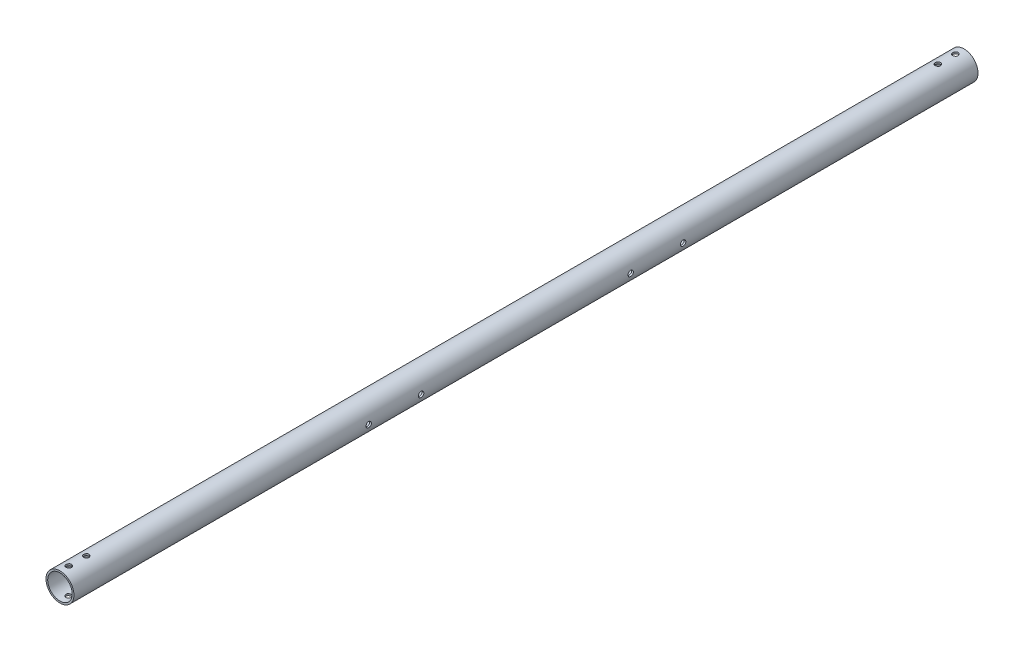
SolidWorks part; units mm, degrees
ref_plane "前视基准面" through (0, 0, 0) normal (0, 0, 1) x (1, 0, 0)
ref_plane "上视基准面" through (0, 0, 0) normal (0, 1, 0) x (1, 0, 0)
ref_plane "右视基准面" through (0, 0, 0) normal (1, 0, 0) x (0, 0, -1)
other "Configuration Table"
sketch "草图1" plane through (0, 0, 0) normal (0, 0, 1) x (1, 0, 0)
  circle A0 centre (0, 0) radius 8
  circle A1 centre (0, 0) radius 7
extrude "凸台-拉伸1" add sketch "草图1" along normal blind 517.5
ref_point "点1"
ref_plane "基准面1" through (0, 0, 0) normal (0, 1, 0) x (1, 0, 0)
sketch "草图2" plane through (0, 0, 0) normal (0, 1, 0) x (1, 0, 0)
  line L0 (-8, -517.5) -> (8, -517.5) construction
  circle A0 centre (0, -5) radius 1.55
  circle A1 centre (0, -15) radius 1.55
  circle A4 centre (0, -502.5) radius 1.55
  circle A5 centre (0, -512.5) radius 1.55
  dimension "D1" = 5
  dimension "D2" = 15
  dimension "D3" = 5
  dimension "D4" = 15
extrude "切除-拉伸1" cut sketch "草图2" against normal through all and the other way through all
ref_plane "基准面2" through (0, 0, 0) normal (1, 0, 0) x (0, 0, -1)
sketch "草图3" plane through (0, 0, 0) normal (1, 0, 0) x (0, 0, -1)
  line L0 (-517.5, 8) -> (-517.5, -8) construction
  circle A0 centre (-348.75, 0) radius 1.55
  circle A1 centre (-318.75, 0) radius 1.55
  circle A2 centre (-168.75, 0) radius 1.55
  circle A3 centre (-198.75, 0) radius 1.55
  dimension "D1" = 30
  dimension "D2" = 168.75
  dimension "D3" = 168.75
  dimension "D4" = 30
extrude "切除-拉伸2" cut sketch "草图3" against normal through all and the other way through all
